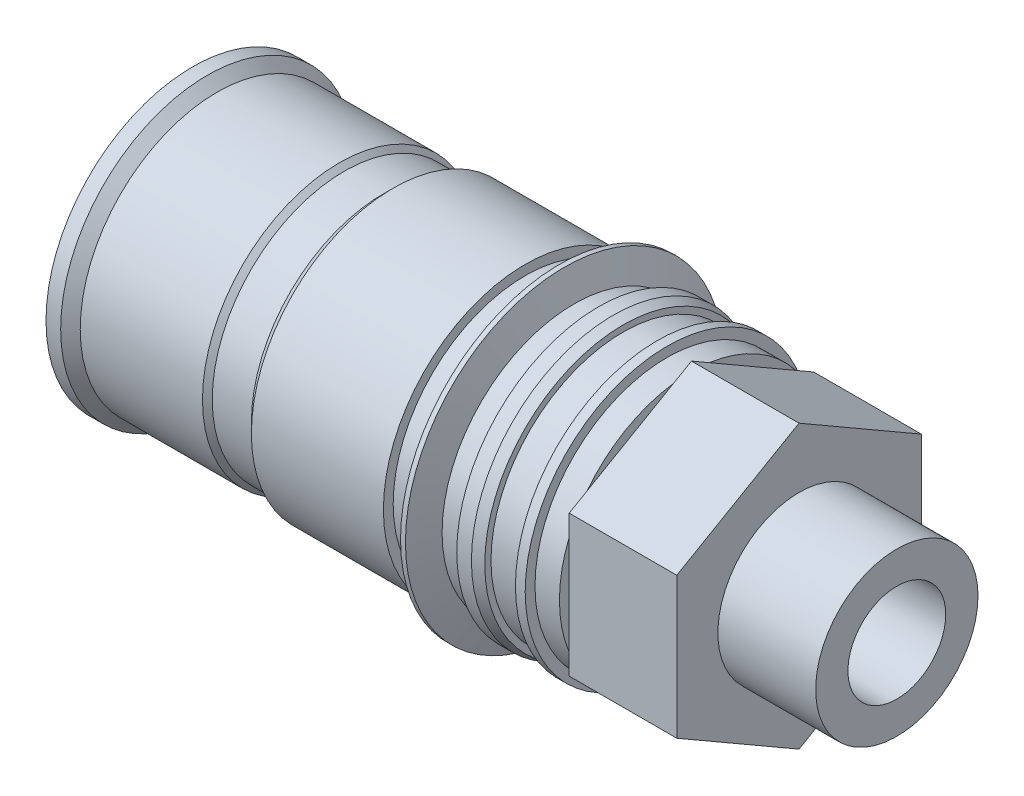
SolidWorks part; units mm, degrees
ref_plane "Alzado" through (0, 0, 0) normal (0, 0, 1) x (1, 0, 0)
ref_plane "Planta" through (0, 0, 0) normal (0, 1, 0) x (1, 0, 0)
ref_plane "Vista lateral" through (0, 0, 0) normal (1, 0, 0) x (0, 0, -1)
sketch "Croquis1" plane through (0, 0, 0) normal (0, 0, 1) x (1, 0, 0)
  line L0 (0, 0) -> (150.0259, 0) construction
  line L1 (0, 0) -> (0, 30)
  line L2 (0, 30) -> (3, 30)
  line L3 (3, 30) -> (5, 28)
  line L4 (5, 28) -> (30, 28)
  line L5 (30, 28) -> (31, 27)
  line L6 (31, 27) -> (39, 27)
  line L7 (39, 27) -> (41, 29)
  line L8 (41, 29) -> (68, 29)
  line L9 (68, 29) -> (68, 27)
  line L10 (68, 27) -> (73, 27)
  line L11 (73, 27) -> (75, 32.495)
  line L12 (75, 32.495) -> (76, 32.495)
  line L13 (76, 32.495) -> (78, 27)
  line L14 (78, 27) -> (83, 27)
  line L15 (83, 27) -> (83, 29)
  line L16 (83, 29) -> (86, 29)
  line L17 (86, 29) -> (88, 28.2721)
  line L18 (88, 28.2721) -> (88, 27)
  line L19 (88, 27) -> (95, 27)
  line L20 (95, 27) -> (95, 29)
  line L21 (95, 29) -> (97, 29)
  line L22 (97, 29) -> (97, 27)
  line L23 (97, 27) -> (102, 27)
  line L24 (102, 27) -> (102, 0)
  line L25 (102, 0) -> (0, 0)
  dimension "D1" = 102
  dimension "D2" = 60
  dimension "D3" = 3
  dimension "D4" = 135
  dimension "D5" = 2
  dimension "D6" = 25
  dimension "D7" = 1
  dimension "D8" = 8
  dimension "D9" = 2
  dimension "D10" = 27
  dimension "D11" = 2
  dimension "D12" = 5
  dimension "D13" = 2
  dimension "D14" = 110
  dimension "D15" = 1
  dimension "D16" = 2
  dimension "D17" = 5
  dimension "D18" = 2
  dimension "D19" = 3
  dimension "D20" = 7
  dimension "D21" = 2
  dimension "D22" = 2
revolve "Revolución1" add sketch "Croquis1" angle 360 about L0
sketch "Croquis2" plane through (102, 0, 0) normal (1, 0, 0) x (0, 0, -1)
  line L1 (0, 28.8675) -> (-25, 14.4338)
  line L2 (-25, 14.4338) -> (-25, -14.4338)
  line L3 (-25, -14.4338) -> (0, -28.8675)
  line L4 (0, -28.8675) -> (25, -14.4338)
  line L5 (25, -14.4338) -> (25, 14.4338)
  line L6 (25, 14.4338) -> (0, 28.8675)
  circle A0 centre (0, 0) radius 25 construction
  dimension "D1" = 50
extrude "Saliente-Extruir1" add sketch "Croquis2" along normal blind 22
sketch "Croquis3" plane through (124, 0, 0) normal (1, 0, 0) x (0, 0, -1)
  circle A0 centre (0, 0) radius 16.6
  dimension "D1" = 33.2
extrude "Saliente-Extruir2" add sketch "Croquis3" along normal blind 20
sketch "Croquis4" plane through (144, 0, 0) normal (1, 0, 0) x (0, 0, -1)
  circle A0 centre (0, 0) radius 10
  dimension "D1" = 20
extrude "Cortar-Extruir1" cut sketch "Croquis4" against normal through all
